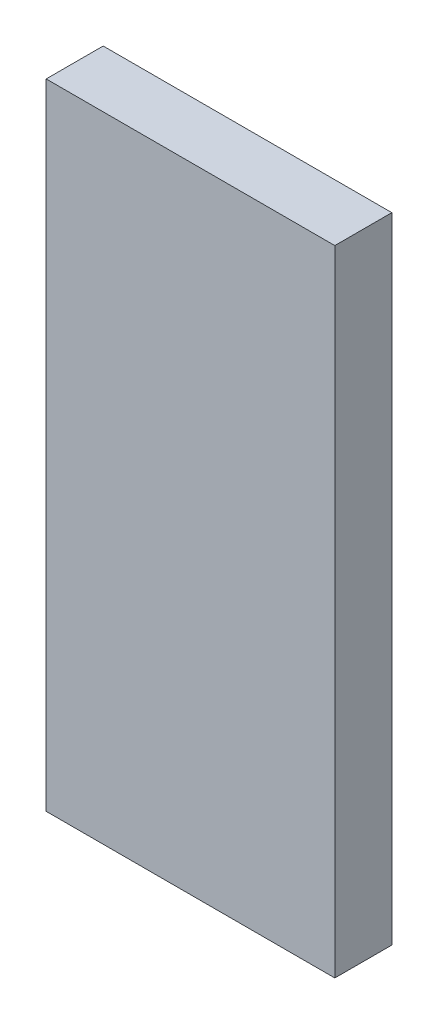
SolidWorks part; units mm, degrees
ref_plane "Plan de face" through (0, 0, 0) normal (0, 0, 1) x (1, 0, 0)
ref_plane "Plan de dessus" through (0, 0, 0) normal (0, 1, 0) x (1, 0, 0)
ref_plane "Plan de droite" through (0, 0, 0) normal (1, 0, 0) x (0, 0, -1)
sketch "Esquisse1" plane through (0, 0, 0) normal (0, 0, 1) x (1, 0, 0)
  line L1 (0, 0) -> (40.5, 0)
  line L2 (0, 0) -> (0, 89)
  line L3 (0, 89) -> (40.5, 89)
  line L4 (40.5, 0) -> (40.5, 89)
  dimension "D1" = 40.5
  dimension "D2" = 89
extrude "Extrusion1" add sketch "Esquisse1" along normal blind 8
